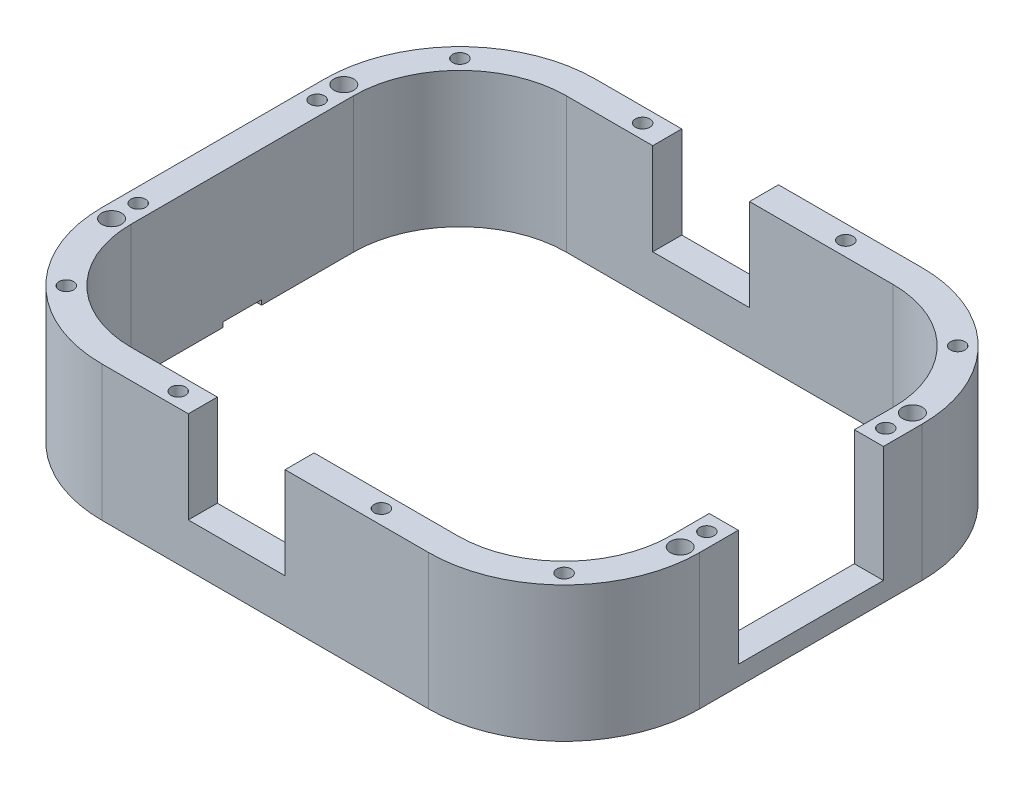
SolidWorks part; units mm, degrees
ref_plane "Front Plane" through (0, 0, 0) normal (0, 0, 1) x (1, 0, 0)
ref_plane "Top Plane" through (0, 0, 0) normal (0, 1, 0) x (1, 0, 0)
ref_plane "Right Plane" through (0, 0, 0) normal (1, 0, 0) x (0, 0, -1)
sketch "Sketch2" plane through (0, 0, 0) normal (0, 1, 0) x (1, 0, 0)
  line L0 (0, 168.275) -> (0, -168.275) construction
  line L1 (-187.9092, 168.275) -> (237.5408, 168.275)
  line L2 (-187.9092, 168.275) -> (-187.9092, -168.275)
  line L3 (-187.9092, -168.275) -> (237.5408, -168.275)
  line L4 (237.5408, 168.275) -> (237.5408, -168.275)
  dimension "D1" = 187.9092
  dimension "D2" = 237.5408
  dimension "D3" = 336.55
extrude "Boss-Extrude1" add sketch "Sketch2" along normal mid plane 88.9
sketch "Sketch3" plane through (0, 44.45, 0) normal (0, 1, 0) x (1, 0, 0)
  line L0 (21.9356, -216.8533) -> (21.9356, 216.8533) construction
  line L1 (219.075, -73.025) -> (219.075, 73.025) construction
  line L3 (21.9356, -161.925) -> (21.9356, 161.925) construction
  line L4 (218.0554, 0) -> (0, 0) construction
  line L5 (-175.2037, -73.025) -> (-175.2037, 73.025) construction
  line L6 (0, 0) -> (-174.1841, 0) construction
  line L10 (129.1554, -161.925) -> (-85.2841, -161.925)
  line L11 (218.0554, -73.025) -> (218.0554, 73.025)
  line L12 (-85.2841, 161.925) -> (129.1554, 161.925)
  line L13 (-174.1841, -73.025) -> (-174.1841, 73.025)
  line L19 (130.175, -161.925) -> (-86.3037, -161.925) construction
  line L21 (-86.3037, 161.925) -> (130.175, 161.925) construction
  arc A1 (-174.1841, -73.025) -> (-85.2841, -161.925) centre (-85.2841, -73.025) ccw
  arc A2 (129.1554, -161.925) -> (218.0554, -73.025) centre (129.1554, -73.025) ccw
  arc A3 (218.0554, 73.025) -> (129.1554, 161.925) centre (129.1554, 73.025) ccw
  arc A7 (163.8008, 155.3203) -> (130.175, 161.925) centre (130.175, 73.025) ccw construction
  arc A8 (130.175, -161.925) -> (163.8008, -155.3203) centre (130.175, -73.025) ccw construction
  arc A11 (-119.9295, -155.3203) -> (-86.3037, -161.925) centre (-86.3037, -73.025) ccw construction
  arc A12 (-85.2841, 161.925) -> (-174.1841, 73.025) centre (-85.2841, 73.025) ccw
  arc A13 (-86.3037, 161.925) -> (-119.9295, 155.3203) centre (-86.3037, 73.025) ccw construction
  arc A18 (219.075, 73.025) -> (130.175, 161.925) centre (130.175, 73.025) ccw construction
  arc A19 (130.175, -161.925) -> (219.075, -73.025) centre (130.175, -73.025) ccw construction
  arc A23 (-175.2037, -73.025) -> (-86.3037, -161.925) centre (-86.3037, -73.025) ccw construction
  arc A24 (-86.3037, 161.925) -> (-175.2037, 73.025) centre (-86.3037, 73.025) ccw construction
  point P31 (21.9356, 0)
  dimension "D1" = 392.2395
  dimension "D2" = 88.9
  dimension "D3" = 323.85
extrude "Cut-Extrude1" cut sketch "Sketch3" against normal through all flip side to cut
sketch "Sketch4" plane through (0, 44.45, 0) normal (0, 1, 0) x (1, 0, 0)
  line L0 (-85.2841, -142.875) -> (129.1554, -142.875)
  line L2 (21.9356, 142.875) -> (21.9356, -142.875) construction
  line L3 (21.9356, 161.925) -> (21.9356, 142.875) construction
  line L4 (129.1554, 161.925) -> (-85.2841, 161.925) construction
  line L15 (130.175, 165.1) -> (23.4431, 165.1) construction
  line L16 (-0.1265, 139.5939) -> (-2.553, 137.0733) construction
  line L17 (-9.7777, 135.7189) -> (-10.0485, 135.9901) construction
  line L22 (129.1554, -161.925) -> (-85.2841, -161.925) construction
  line L23 (199.0054, -73.025) -> (199.0054, 73.025)
  line L24 (-86.3037, 161.925) -> (130.175, 161.925) construction
  line L37 (-155.1341, -73.025) -> (-155.1341, 73.025)
  line L38 (-85.2841, 142.875) -> (129.1554, 142.875)
  arc A0 (218.0554, 73.025) -> (129.1554, 161.925) centre (129.1554, 73.025) ccw construction
  arc A1 (129.1554, -161.925) -> (218.0554, -73.025) centre (129.1554, -73.025) ccw construction
  arc A2 (-174.1841, -73.025) -> (-85.2841, -161.925) centre (-85.2841, -73.025) ccw construction
  arc A3 (-85.2841, 161.925) -> (-174.1841, 73.025) centre (-85.2841, 73.025) ccw construction
  arc A15 (-73.025, -161.925) -> (-7.9181, -134.9569) centre (-73.025, -69.85) ccw construction
  arc A17 (1.5681, -134.9569) -> (66.675, -161.925) centre (66.675, -69.85) ccw construction
  arc A20 (23.4431, 165.1) -> (-0.1265, 139.5939) centre (81.8309, 87.5018) ccw construction
  arc A21 (-9.7777, 135.7189) -> (-2.553, 137.0733) centre (-6.9872, 140.7799) ccw construction
  arc A29 (129.1554, -142.875) -> (199.0054, -73.025) centre (129.1554, -73.025) ccw
  arc A30 (199.0054, 73.025) -> (129.1554, 142.875) centre (129.1554, 73.025) ccw
  arc A42 (-155.1341, -73.025) -> (-85.2841, -142.875) centre (-85.2841, -73.025) ccw
  arc A43 (-85.2841, 142.875) -> (-155.1341, 73.025) centre (-85.2841, 73.025) ccw
  dimension "D1" = 19.05
extrude "Cut-Extrude3" cut sketch "Sketch4" against normal through all
sketch "Sketch5" plane through (0, 44.45, 0) normal (0, -1, 0) x (1, 0, 0)
  line L1 (-28.575, 161.925) -> (34.925, 161.925)
  line L2 (-28.575, 161.925) -> (-28.575, -161.925)
  line L3 (-28.575, -161.925) -> (34.925, -161.925)
  line L4 (34.925, 161.925) -> (34.925, -161.925)
  line L5 (-28.575, 161.925) -> (34.925, -161.925) construction
  line L6 (-28.575, -161.925) -> (34.925, 161.925) construction
  line L8 (-85.2841, 161.925) -> (129.1554, 161.925) construction
  point P0 (3.175, 0)
  dimension "D1" = 63.5
  dimension "D2" = 3.175
extrude "Cut-Extrude4" cut sketch "Sketch5" along normal blind 60.325
sketch "Sketch6" plane through (218.0554, 0, 0) normal (1, 0, 0) x (0, 0, -1)
  line L0 (0, 44.45) -> (0, 6.35) construction
  line L2 (47.625, 44.45) -> (47.625, -31.75)
  line L3 (-47.625, 44.45) -> (-47.625, -31.75)
  line L4 (-47.625, -31.75) -> (47.625, -31.75)
  line L8 (178.1175, 0) -> (-178.1175, 0) construction
  line L9 (-73.025, 44.45) -> (73.025, 44.45) construction
  arc A0 (47.625, 44.45) -> (-47.625, 44.45) centre (0, 44.45) ccw
  point P5 (29.6978, 27.6265)
  dimension "D1" = 95.25
  dimension "D2" = 31.75
extrude "Cut-Extrude5" cut sketch "Sketch6" against normal blind 19.05
hole_wizard "Hole1" positions "Sketch8" profile "Sketch7" legacy
sketch "Sketch8" plane through (0, 44.45, 0) normal (0, 1, 0) x (1, 0, 0)
  circle A0 centre (-44.7394, -152.4) radius 2.5527 construction
  arc A1 (-174.1841, -73.025) -> (-85.2841, -161.925) centre (-85.2841, -73.025) ccw construction
  point P0 (-44.7394, -152.4)
  point P4 (-141.4107, 129.1516)
  point P7 (-164.6591, 58.7375)
  point P14 (-141.4107, -129.1516)
  point P17 (-164.6591, -58.7375)
  point P20 (88.6106, -152.4)
  point P23 (185.282, -129.1516)
  point P26 (208.5304, -58.7375)
  point P29 (208.5304, 58.7375)
  point P32 (185.282, 129.1516)
  point P39 (88.6106, 152.4)
  point P42 (-44.7394, 152.4)
  dimension "D1" = 9.525
sketch "Sketch7" plane through (-44.7394, 44.45, 152.4) normal (1, 0, 0) x (0, 0, 1)
  line L0 (0, 0) -> (0, 88.9)
  line L1 (0, 88.9) -> (4.7625, 88.9)
  line L2 (4.7625, 88.9) -> (4.7625, 0)
  line L3 (4.7625, 0) -> (0, 0)
  line L4 (0, 110) -> (0, -10) construction
  dimension "Diameter" = 9.525
  dimension "Depth" = 88.9
sketch "Sketch9" plane through (0, -44.45, 0) normal (0, -1, 0) x (1, 0, 0)
  line L0 (-155.1341, -73.025) -> (-155.1341, 73.025) construction
  line L1 (-137.6716, 12.7) -> (-156.7216, 12.7)
  line L2 (-137.6716, 12.7) -> (-137.6716, -12.7)
  line L3 (-137.6716, -12.7) -> (-156.7216, -12.7)
  line L4 (-163.0716, 6.35) -> (-163.0716, -6.35)
  line L5 (-137.6716, 0) -> (0, 0) construction
  arc A0 (-156.7216, -12.7) -> (-163.0716, -6.35) centre (-156.7216, -6.35) cw
  arc A1 (-163.0716, 6.35) -> (-156.7216, 12.7) centre (-156.7216, 6.35) cw
  dimension "D1" = 6.35
  dimension "D2" = 7.9375
  dimension "D3" = 25.4
  dimension "D4" = 25.4
extrude "Cut-Extrude6" cut sketch "Sketch9" against normal blind 3.175
hole_wizard "Hole2" positions "Sketch11" profile "Sketch10" legacy
sketch "Sketch11" plane through (0, 44.45, 0) normal (0, 1, 0) x (1, 0, 0)
  circle A0 centre (-164.6591, -76.2) radius 3.302 construction
  circle A1 centre (-164.6591, 76.2) radius 3.302 construction
  circle A2 centre (208.5304, 76.2) radius 3.302 construction
  circle A3 centre (208.5304, -76.2) radius 3.302 construction
  point P0 (-164.6591, 76.2)
  point P1 (-164.6591, -76.2)
  point P3 (208.5304, -76.2)
  point P5 (208.5304, 76.2)
sketch "Sketch10" plane through (-164.6591, 44.45, -76.2) normal (1, 0, 0) x (0, 0, 1)
  line L0 (0, 0) -> (0, 88.9)
  line L1 (0, 88.9) -> (6.5, 88.9)
  line L2 (6.5, 88.9) -> (6.5, 0)
  line L3 (6.5, 0) -> (0, 0)
  line L4 (0, 110) -> (0, -10) construction
  dimension "Diameter" = 13
  dimension "Depth" = 88.9
